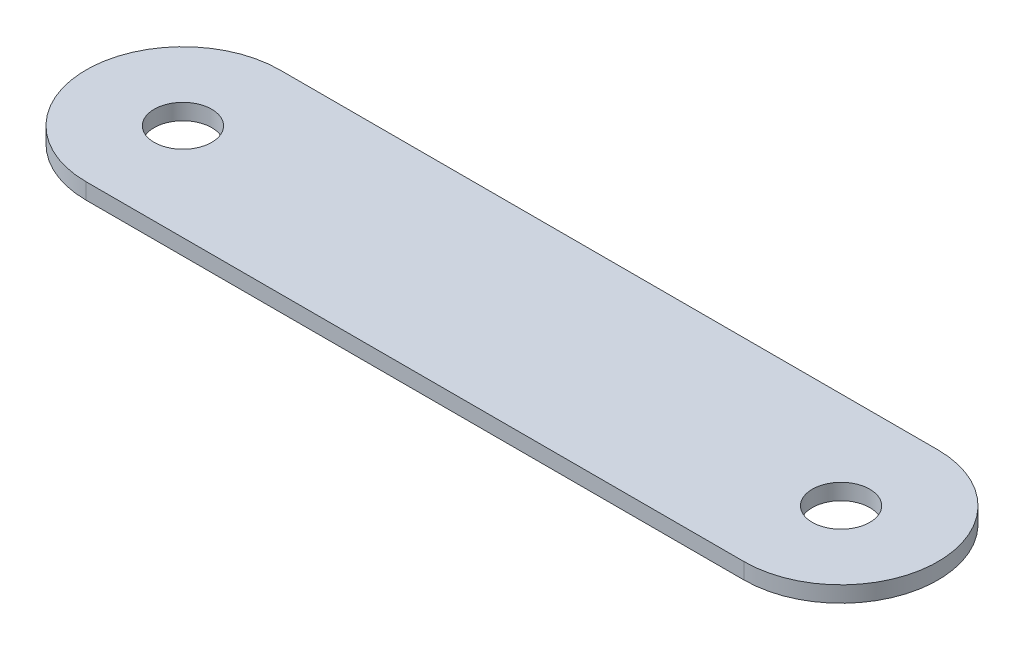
SolidWorks part; units mm, degrees
ref_plane "Front" through (0, 0, 0) normal (0, 0, 1) x (1, 0, 0)
ref_plane "Top" through (0, 0, 0) normal (0, 1, 0) x (1, 0, 0)
ref_plane "Right" through (0, 0, 0) normal (1, 0, 0) x (0, 0, -1)
sketch "Sketch1" plane through (0, 0, 0) normal (0, 1, 0) x (1, 0, 0)
  line L0 (-61.8, 0) -> (61.8, 0) construction
  line L1 (-61.8, 18.193) -> (61.8, 18.193)
  line L2 (-61.8, -18.193) -> (61.8, -18.193)
  arc A0 (-61.8, 18.193) -> (-61.8, -18.193) centre (-61.8, 0) ccw
  arc A1 (61.8, -18.193) -> (61.8, 18.193) centre (61.8, 0) ccw
  circle A2 centre (-61.8, 0) radius 5.4
  circle A4 centre (61.8, 0) radius 5.4
  point P2 (61.8, 0)
  point P3 (0, 0)
  point P9 (0, 0)
  dimension "D1" = 10.8
  dimension "D2" = 18.193
  dimension "D4" = 10.8
  dimension "D3" = 123.6
extrude "Boss-Extrude1" add sketch "Sketch1" along normal blind 3
